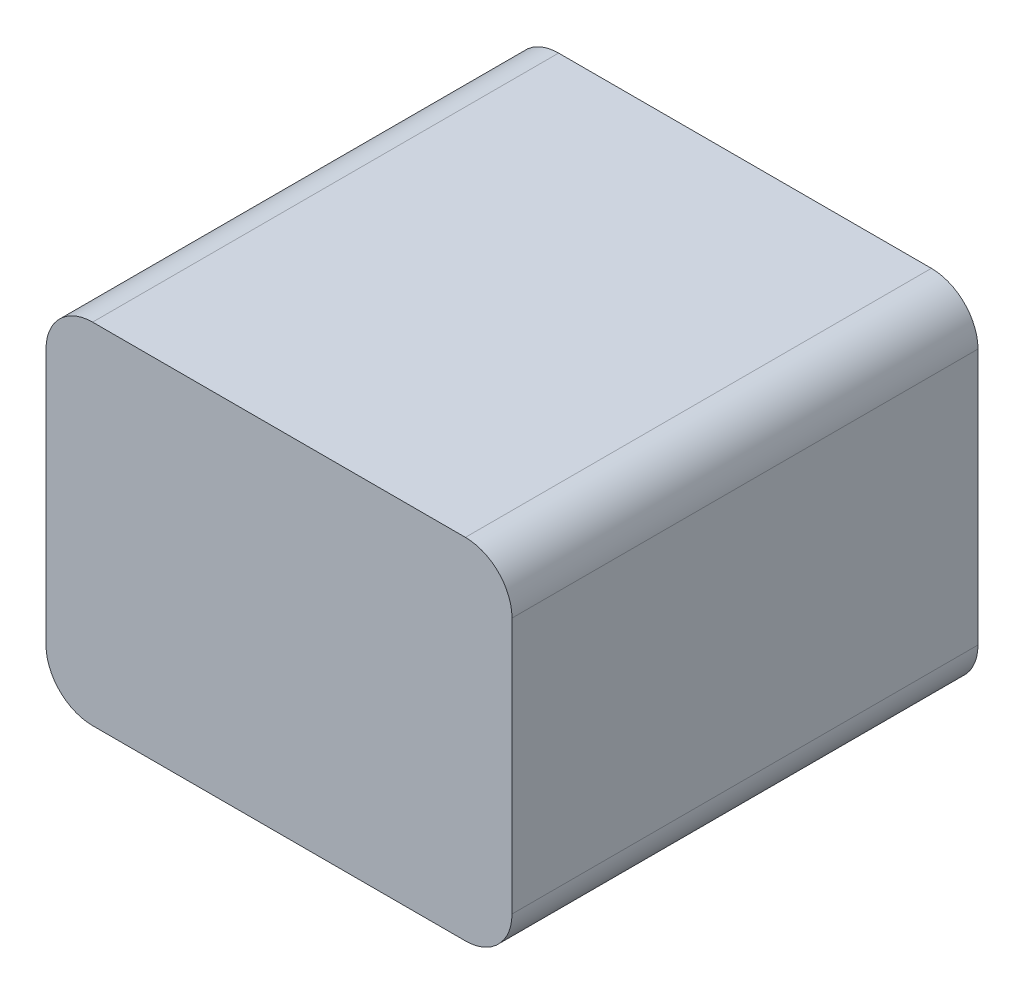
SolidWorks part; units mm, degrees
ref_plane "Front Plane" through (0, 0, 0) normal (0, 0, 1) x (1, 0, 0)
ref_plane "Top Plane" through (0, 0, 0) normal (0, 1, 0) x (1, 0, 0)
ref_plane "Right Plane" through (0, 0, 0) normal (1, 0, 0) x (0, 0, -1)
sketch "Sketch2" plane through (0, 0, 0) normal (0, 0, 1) x (1, 0, 0)
  line L1 (-10.16, 9.525) -> (10.16, 9.525)
  line L2 (-12.7, 6.985) -> (-12.7, -6.985)
  line L3 (-10.16, -9.525) -> (10.16, -9.525)
  line L4 (12.7, 6.985) -> (12.7, -6.985)
  line L5 (-12.7, 9.525) -> (12.7, -9.525) construction
  line L6 (-12.7, -9.525) -> (12.7, 9.525) construction
  arc A0 (10.16, 9.525) -> (12.7, 6.985) centre (10.16, 6.985) cw
  arc A1 (10.16, -9.525) -> (12.7, -6.985) centre (10.16, -6.985) ccw
  arc A2 (-12.7, -6.985) -> (-10.16, -9.525) centre (-10.16, -6.985) ccw
  arc A3 (-10.16, 9.525) -> (-12.7, 6.985) centre (-10.16, 6.985) ccw
  point P0 (0, 0)
  dimension "D3" = 2.54
  dimension "D1" = 25.4
  dimension "D2" = 19.05
extrude "Boss-Extrude1" add sketch "Sketch2" along normal mid plane 25.4
sketch "Sketch3" plane through (-12.7, 0, 0) normal (-1, 0, 0) x (0, 0, 1)
  line L1 (-8.89, 3.81) -> (8.89, 3.81)
  line L2 (-8.89, 3.81) -> (-8.89, -3.81)
  line L3 (-8.89, -3.81) -> (8.89, -3.81)
  line L4 (8.89, 3.81) -> (8.89, -3.81)
  line L5 (-8.89, 3.81) -> (8.89, -3.81) construction
  line L6 (-8.89, -3.81) -> (8.89, 3.81) construction
  point P0 (0, 0)
  dimension "D1" = 17.78
  dimension "D2" = 7.62
extrude "Boss-Extrude2" add sketch "Sketch3" along normal blind 1.27
fillet "Fillet1" radius 2.54 4 edges at (-13.335, 3.81, -8.89) (-13.335, 3.81, 8.89) (-13.335, -3.81, -8.89) (-13.335, -3.81, 8.89)
shell "Shell1" thickness 2.54
